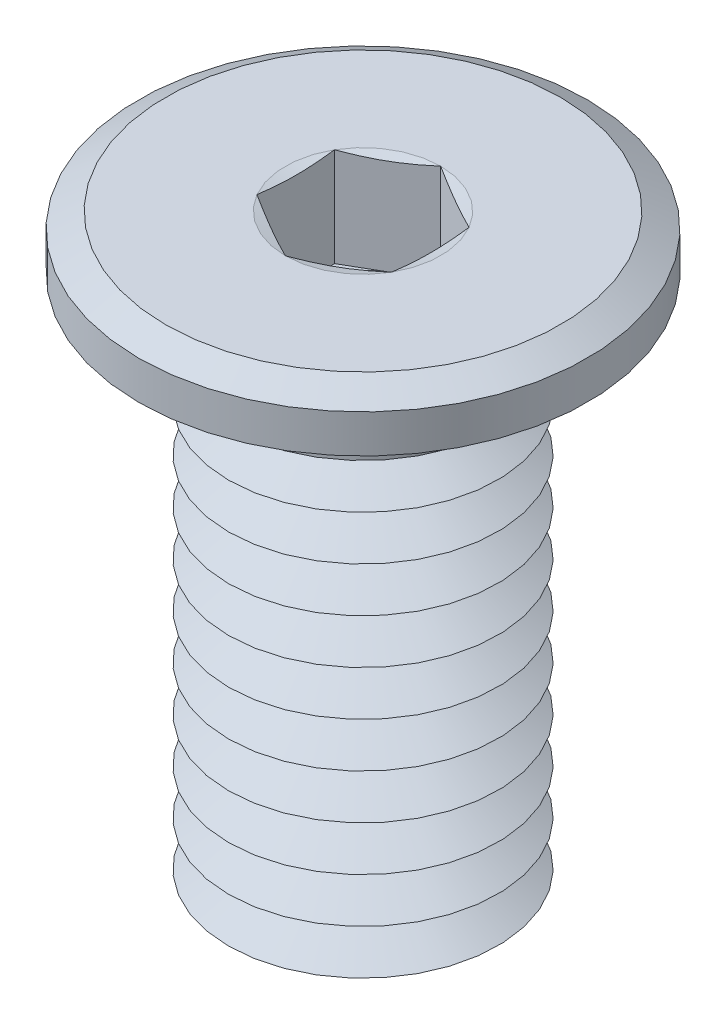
SolidWorks part; units mm, degrees
ref_plane "Front Plane" through (0, 0, 0) normal (0, 0, 1) x (1, 0, 0)
ref_plane "Top Plane" through (0, 0, 0) normal (0, 1, 0) x (1, 0, 0)
ref_plane "Right Plane" through (0, 0, 0) normal (1, 0, 0) x (0, 0, -1)
sketch "Sketch1" plane through (0, 0, 0) normal (0, 1, 0) x (1, 0, 0)
  circle A0 centre (0, 0) radius 5
  dimension "D1" = 10
extrude "Boss-Extrude1" add sketch "Sketch1" against normal blind 1.2
sketch "Sketch2" plane through (0, -1.2, 0) normal (0, -1, 0) x (1, 0, 0)
  circle A0 centre (0, 0) radius 3
  dimension "D1" = 6
extrude "Boss-Extrude2" add sketch "Sketch2" along normal blind 12
sketch "Sketch3" plane through (0, 0, 0) normal (1, 0, 0) x (0, 0, -1)
  line L0 (0, 0.9906) -> (0, -8.2999) construction
sketch "Sketch5" plane through (0, 0, 0) normal (1, 0, 0) x (0, 0, -1)
  line L0 (-3, -13.7) -> (-2.134, -13.2)
  line L1 (-3, -1.2) -> (-3, -13.2) construction
  line L2 (-2.134, -13.2) -> (-3, -12.7)
  line L3 (-3, -1.2) -> (-3, -13.2) construction
  line L4 (-3, -12.7) -> (-3, -13.7)
  line L6 (-3, -1.2) -> (-3, -13.2) construction
  line L7 (-3, -1.2) -> (-3, -13.2) construction
  line L14 (-3, -13.2) -> (3, -13.2) construction
  dimension "D1" = 1
revolve "Cut-Revolve1" cut sketch "Sketch5" angle 360 about L0
pattern_linear "LPattern1" count 11 spacing 1 along (0, 1, 0) of "Cut-Revolve1"
fillet "Fillet1" radius 0.25 1 edges at (0, -1.2, -3)
chamfer "Chamfer2" distance 0.6 angle 30 1 edges at (0, 0, 5)
sketch "Sketch6" plane through (0, 0, 0) normal (0, 1, 0) x (1, 0, 0)
  line L1 (0, 1.7321) -> (-1.5, 0.866)
  line L2 (-1.5, 0.866) -> (-1.5, -0.866)
  line L3 (-1.5, -0.866) -> (0, -1.7321)
  line L4 (0, -1.7321) -> (1.5, -0.866)
  line L5 (1.5, -0.866) -> (1.5, 0.866)
  line L6 (1.5, 0.866) -> (0, 1.7321)
  circle A0 centre (0, 0) radius 1.5 construction
  dimension "D1" = 3
extrude "Cut-Extrude1" cut sketch "Sketch6" against normal blind 2.2
sketch "Sketch7" plane through (0, -2.2, 0) normal (0, 1, 0) x (1, 0, 0)
  line L0 (-1.5, 0.866) -> (-1.5, -0.866) construction
  circle A0 centre (0, 0) radius 1.5
extrude "Cut-Extrude2" cut sketch "Sketch7" against normal through all draft 60
sketch "Sketch8" plane through (0, 0, 0) normal (0, 1, 0) x (1, 0, 0)
  circle A0 centre (0, 0) radius 1.7321
extrude "Cut-Extrude3" cut sketch "Sketch8" against normal through all draft 75
